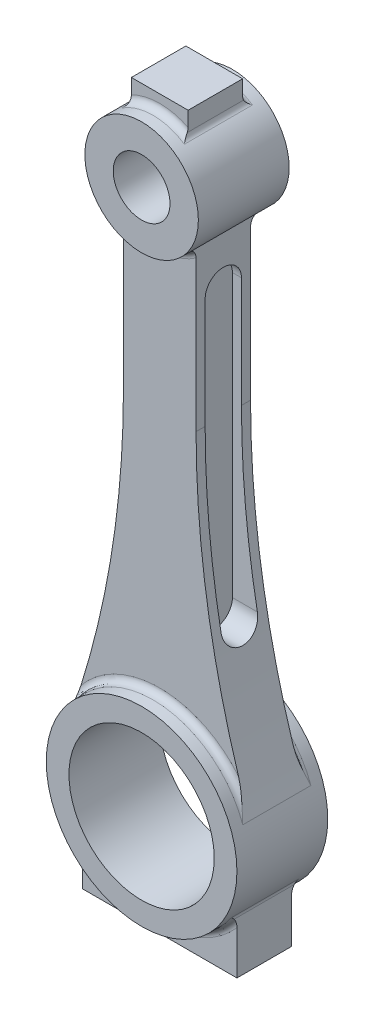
SolidWorks part; units mm, degrees
ref_plane "Front Plane" through (0, 0, 0) normal (0, 0, 1) x (1, 0, 0)
ref_plane "Top Plane" through (0, 0, 0) normal (0, 1, 0) x (1, 0, 0)
ref_plane "Right Plane" through (0, 0, 0) normal (1, 0, 0) x (0, 0, -1)
sketch "Sketch1" plane through (0, 0, 0) normal (0, 0, 1) x (1, 0, 0)
  circle A0 centre (0, -23.7036) radius 21
  circle A1 centre (0, -23.7036) radius 16
  circle A2 centre (0, 96.2964) radius 12.5
  circle A3 centre (0, 96.2964) radius 6.25
  dimension "D1" = 42
  dimension "D2" = 32
  dimension "D3" = 25
  dimension "D4" = 12.5
  dimension "D5" = 120
extrude "Boss-Extrude1" add sketch "Sketch1" along normal mid plane 20
sketch "Sketch2" plane through (0, 0, 0) normal (0, 0, 1) x (1, 0, 0)
  line L0 (8, 86.6918) -> (8, 51.6918)
  line L1 (0, 96.2964) -> (0, 68.6971) construction
  line L2 (-8, 86.6918) -> (-8, 51.6918)
  circle A0 centre (0, -23.7036) radius 21 construction
  circle A1 centre (0, 96.2964) radius 12.5 construction
  arc A2 (19.7874, -16.6708) -> (-19.7874, -16.6708) centre (0, -23.7036) ccw
  arc A3 (-8, 86.6918) -> (8, 86.6918) centre (0, 96.2964) ccw
  arc A5 (8, 51.6918) -> (19.7874, -16.6708) centre (212.1328, 51.6918) ccw
  arc A6 (-8, 51.6918) -> (-19.7874, -16.6708) centre (-212.1328, 51.6918) cw
  dimension "D2" = 35
  dimension "D1" = 8
extrude "Boss-Extrude2" add sketch "Sketch2" along normal mid plane 12
sketch "Sketch3" plane through (0, 0, 0) normal (0, 0, 1) x (1, 0, 0)
  line L0 (0, 96.2964) -> (0, 114.2469) construction
  line L1 (0, 96.2964) -> (0, -56.7132) construction
  line L2 (-6.25, 107.1218) -> (-6.25, 112.1218)
  line L3 (6.25, 107.1218) -> (6.25, 112.1218)
  line L4 (-6.25, 112.1218) -> (6.25, 112.1218)
  line L5 (-17, -36.0324) -> (-17, -48.0324)
  line L6 (17, -36.0324) -> (17, -48.0324)
  line L7 (-17, -48.0324) -> (17, -48.0324)
  circle A1 centre (0, 96.2964) radius 12.5 construction
  arc A2 (0, 83.7964) -> (-6.25, 107.1218) centre (0, 96.2964) ccw
  circle A4 centre (0, -23.7036) radius 21
  arc A5 (0, -2.7036) -> (17, -36.0324) centre (0, -23.7036) ccw
  dimension "D1" = 5
  dimension "D2" = 12.5
  dimension "D3" = 0
  dimension "D4" = 12
  dimension "D5" = 34
extrude "Boss-Extrude4" add sketch "Sketch3" along normal mid plane 12 contours A2 L3 L4 L2 | A5 L5 L7 L6
fillet "Fillet1" radius 1.5 8 edges at (0, -2.7036, -6) (0, -2.7036, 6) (0, 83.7964, 6) (0, 83.7964, -6) (-6.25, 107.1218, 0) (0, 108.7964, 6) (6.25, 107.1218, 0) (0, 108.7964, -6)
fillet "Fillet2" radius 1.5 4 edges at (17, -36.0324, 0) (-17, -36.0324, 0) (0, -44.7036, 6) (0, -44.7036, -6)
ref_plane "Plane1" through (6, 0, 0) normal (1, 0, 0) x (0, 0, -1)
sketch "Sketch5" plane through (6, 0, 0) normal (1, 0, 0) x (0, 0, -1)
  line L0 (0, 76.0362) -> (0, 14.0362) construction
  line L1 (4, 76.0362) -> (4, 14.0362)
  line L2 (-4, 76.0362) -> (-4, 14.0362)
  line L3 (-10, 96.0362) -> (10, 96.0362) construction
  line L4 (-10, 108.7964) -> (-10, 83.7964) construction
  line L5 (10, 83.7964) -> (10, 108.7964) construction
  arc A0 (4, 76.0362) -> (-4, 76.0362) centre (0, 76.0362) ccw
  arc A1 (-4, 14.0362) -> (4, 14.0362) centre (0, 14.0362) ccw
  point P3 (0, 45.0362)
  dimension "D1" = 4
  dimension "D2" = 62
  dimension "D3" = 20
extrude "Cut-Extrude1" cut sketch "Sketch5" along normal blind 62
mirror "Mirror1" about plane through (0, 0, 0) normal (1, 0, 0) of "Cut-Extrude1"
